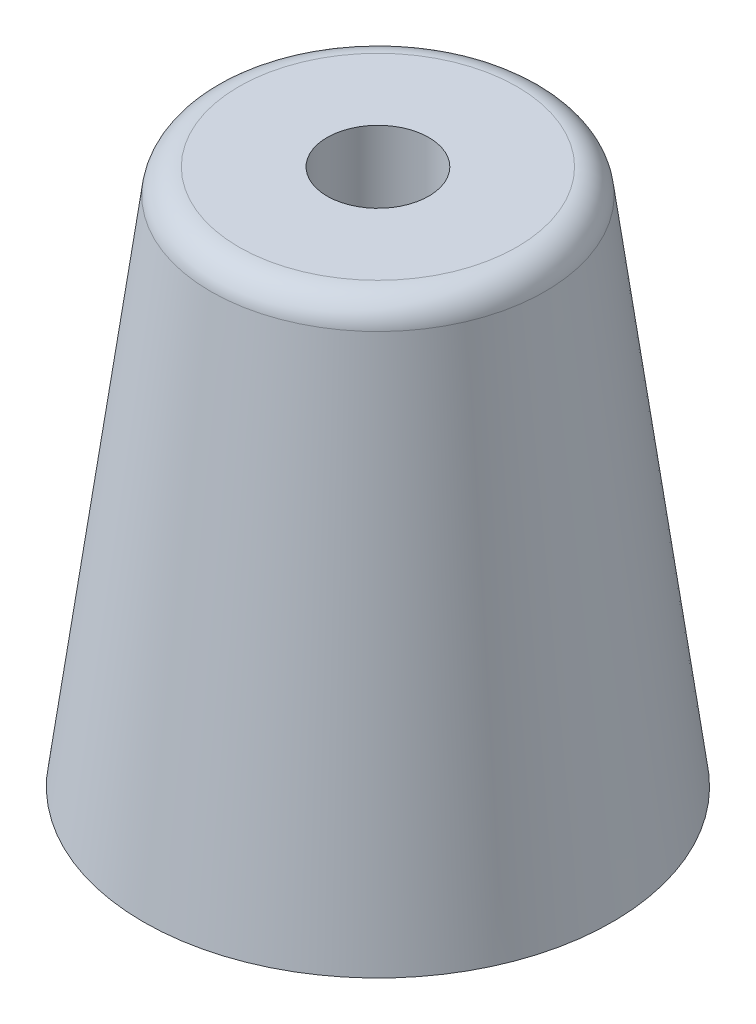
SolidWorks part; units mm, degrees
ref_plane "Plan de face" through (0, 0, 0) normal (0, 0, 1) x (1, 0, 0)
ref_plane "Plan de dessus" through (0, 0, 0) normal (0, 1, 0) x (1, 0, 0)
ref_plane "Plan de droite" through (0, 0, 0) normal (1, 0, 0) x (0, 0, -1)
sketch "Esquisse1" plane through (0, 0, 0) normal (0, 1, 0) x (1, 0, 0)
  circle A0 centre (0, 0) radius 41.5
  dimension "D1" = 83
extrude "Extrusion1" add sketch "Esquisse1" along normal blind 95
draft "Dépouille2" type of draft neutral plane draft angle 7.5 faces to draft 1 parameters "D1"=7.5
fillet "Congé1" radius 5 1 edges at (0, 95, 28.993)
sketch "Esquisse2" plane through (0, 95, 0) normal (0, 1, 0) x (1, 0, 0)
  circle A0 centre (0, 0) radius 9
  dimension "D1" = 18
extrude "Enlèv. mat.-Extru.1" cut sketch "Esquisse2" against normal blind 40
sketch "Esquisse3" plane through (0, 55, 0) normal (0, 1, 0) x (1, 0, 0)
  circle A0 centre (0, 0) radius 5.5
  dimension "D1" = 11
extrude "Enlèv. mat.-Extru.2" cut sketch "Esquisse3" against normal through all
sketch "Esquisse4" plane through (0, 0, 0) normal (0, -1, 0) x (1, 0, 0)
  circle A0 centre (0, 0) radius 35
  dimension "D1" = 70
extrude "Enlèv. mat.-Extru.3" cut sketch "Esquisse4" against normal blind 45 draft 15
sketch "Esquisse6" plane through (0, 0, 0) normal (0, -1, 0) x (1, 0, 0)
  line L0 (-43.2559, 0) -> (46.8249, 0)
ref_plane "Plan1" through (0, 0, 0) normal (0, -0.2588, 0.9659) x (-1, 0, 0)
ref_plane "Plan2" through (0, 8.7502, -32.656) normal (0, -0.2588, 0.9659) x (1, 0, 0)
sketch "Esquisse7" plane through (0, 8.7502, -32.656) normal (0, -0.2588, 0.9659) x (1, 0, 0)
  line L0 (0, -13.8826) -> (0, 44.8902) construction
  line L2 (-3.5, 37.5983) -> (3.5, 37.5983)
  line L3 (-3.5, 37.5983) -> (-3.5, 0.5983)
  line L4 (-3.5, 0.5983) -> (3.5, 0.5983)
  line L5 (3.5, 37.5983) -> (3.5, 0.5983)
  ellipse E0 centre (0, 43.4667) end of major axis (5.5, 43.4667) minor radius 1.4235 construction
  ellipse E1 centre (0, 43.4667) end of major axis (-22.9423, 43.4667) minor radius 5.9379 construction
  dimension "D1" = 3.5
  dimension "D2" = 3.5
  dimension "D3" = 37
extrude "Extrusion2" add sketch "Esquisse7" along normal blind 2
fillet "Congé2" radius 3.5 2 edges at (-3.5, 9.0455, -31.4468) (3.5, 9.0455, -31.4468)
